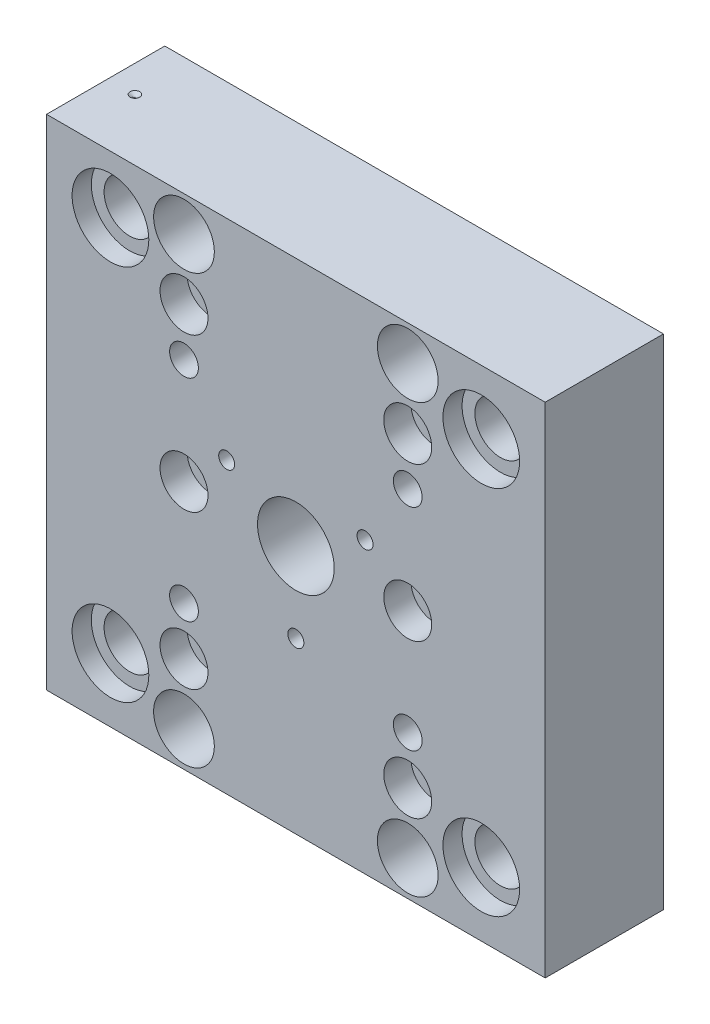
SolidWorks part; units mm, degrees
ref_plane "Plan de face" through (0, 0, 0) normal (0, 0, 1) x (1, 0, 0)
ref_plane "Plan de dessus" through (0, 0, 0) normal (0, 1, 0) x (1, 0, 0)
ref_plane "Plan de droite" through (0, 0, 0) normal (1, 0, 0) x (0, 0, -1)
sketch "Esquisse1" plane through (0, 0, 0) normal (0, 0, 1) x (1, 0, 0)
  line L0 (-78, -78) -> (78, -78)
  line L1 (78, -78) -> (78, 78)
  line L2 (78, 78) -> (-78, 78)
  line L3 (-78, 78) -> (-78, -78)
  circle A0 centre (35, -67) radius 9.5
  circle A1 centre (35, 67) radius 9.5
  circle A2 centre (-35, 67) radius 9.5
  circle A3 centre (-35, -67) radius 9.5
extrude "Extrusion1" add sketch "Esquisse1" along normal blind 37
ref_plane "Plan1" through (0, 0, 37) normal (0, 0, 1) x (1, 0, 0)
sketch "Esquisse2" plane through (0, 0, 37) normal (0, 0, 1) x (1, 0, 0)
  circle A0 centre (-58, 60) radius 8
sketch "Esquisse3" plane through (0, 0, 37) normal (0, 0, 1) x (1, 0, 0)
  circle A0 centre (58, 58) radius 8
sketch "Esquisse4" plane through (0, 0, 37) normal (0, 0, 1) x (1, 0, 0)
  circle A0 centre (58, -58) radius 8
sketch "Esquisse5" plane through (0, 0, 37) normal (0, 0, 1) x (1, 0, 0)
  circle A0 centre (-58, -58) radius 8
sketch "Esquisse6" plane through (0, 0, 37) normal (0, 0, 1) x (1, 0, 0)
  circle A0 centre (-35, 48) radius 7.5
extrude "Enlèv. mat.-Extru.1" cut sketch "Esquisse6" against normal blind 8.5
sketch "Esquisse7" plane through (0, 0, 37) normal (0, 0, 1) x (1, 0, 0)
  circle A0 centre (35, 48) radius 7.5
extrude "Enlèv. mat.-Extru.2" cut sketch "Esquisse7" against normal blind 8.5
sketch "Esquisse8" plane through (0, 0, 37) normal (0, 0, 1) x (1, 0, 0)
  circle A0 centre (-35, 0) radius 7.5
extrude "Enlèv. mat.-Extru.3" cut sketch "Esquisse8" against normal blind 8.5
sketch "Esquisse9" plane through (0, 0, 37) normal (0, 0, 1) x (1, 0, 0)
  circle A0 centre (35, 0) radius 7.5
extrude "Enlèv. mat.-Extru.4" cut sketch "Esquisse9" against normal blind 8.5
sketch "Esquisse10" plane through (0, 0, 37) normal (0, 0, 1) x (1, 0, 0)
  circle A0 centre (-35, -48) radius 7.5
extrude "Enlèv. mat.-Extru.5" cut sketch "Esquisse10" against normal blind 8.5
sketch "Esquisse11" plane through (0, 0, 37) normal (0, 0, 1) x (1, 0, 0)
  circle A0 centre (35, -48) radius 7.5
extrude "Enlèv. mat.-Extru.6" cut sketch "Esquisse11" against normal blind 8.5
sketch "Esquisse12" plane through (0, 0, 37) normal (0, 0, 1) x (1, 0, 0)
  circle A0 centre (35, -48) radius 4.5
extrude "Enlèv. mat.-Extru.7" cut sketch "Esquisse12" against normal blind 37
sketch "Esquisse13" plane through (0, 0, 37) normal (0, 0, 1) x (1, 0, 0)
  circle A0 centre (-35, -48) radius 4.5
extrude "Enlèv. mat.-Extru.8" cut sketch "Esquisse13" against normal blind 37
sketch "Esquisse14" plane through (0, 0, 37) normal (0, 0, 1) x (1, 0, 0)
  circle A0 centre (35, 0) radius 4.5
extrude "Enlèv. mat.-Extru.9" cut sketch "Esquisse14" against normal blind 37
sketch "Esquisse15" plane through (0, 0, 37) normal (0, 0, 1) x (1, 0, 0)
  circle A0 centre (-35, 0) radius 4.5
extrude "Enlèv. mat.-Extru.10" cut sketch "Esquisse15" against normal blind 37
sketch "Esquisse16" plane through (0, 0, 37) normal (0, 0, 1) x (1, 0, 0)
  circle A0 centre (-35, 48) radius 4.5
extrude "Enlèv. mat.-Extru.11" cut sketch "Esquisse16" against normal blind 37
sketch "Esquisse17" plane through (0, 0, 37) normal (0, 0, 1) x (1, 0, 0)
  circle A0 centre (35, 48) radius 4.5
extrude "Enlèv. mat.-Extru.12" cut sketch "Esquisse17" against normal blind 37
sketch "Esquisse18" plane through (0, 0, 37) normal (0, 0, 1) x (1, 0, 0)
  circle A0 centre (-35, 33) radius 4.5
extrude "Enlèv. mat.-Extru.13" cut sketch "Esquisse18" against normal blind 14
sketch "Esquisse19" plane through (0, 0, 37) normal (0, 0, 1) x (1, 0, 0)
  circle A0 centre (35, 33) radius 4.5
extrude "Enlèv. mat.-Extru.14" cut sketch "Esquisse19" against normal blind 14
sketch "Esquisse20" plane through (0, 0, 37) normal (0, 0, 1) x (1, 0, 0)
  circle A0 centre (35, -33) radius 4.5
extrude "Enlèv. mat.-Extru.15" cut sketch "Esquisse20" against normal blind 14
sketch "Esquisse21" plane through (0, 0, 37) normal (0, 0, 1) x (1, 0, 0)
  circle A0 centre (-35, -33) radius 4.5
extrude "Enlèv. mat.-Extru.16" cut sketch "Esquisse21" against normal blind 14
sketch "Esquisse22" plane through (0, 0, 37) normal (0, 0, 1) x (1, 0, 0)
  circle A0 centre (-35, -33) radius 4
extrude "Enlèv. mat.-Extru.17" cut sketch "Esquisse22" against normal blind 37
sketch "Esquisse23" plane through (0, 0, 37) normal (0, 0, 1) x (1, 0, 0)
  circle A0 centre (35, -33) radius 4
extrude "Enlèv. mat.-Extru.18" cut sketch "Esquisse23" against normal blind 37
sketch "Esquisse24" plane through (0, 0, 37) normal (0, 0, 1) x (1, 0, 0)
  circle A0 centre (35, 33) radius 4
extrude "Enlèv. mat.-Extru.19" cut sketch "Esquisse24" against normal blind 37
sketch "Esquisse25" plane through (0, 0, 37) normal (0, 0, 1) x (1, 0, 0)
  circle A0 centre (-35, 33) radius 4
extrude "Enlèv. mat.-Extru.20" cut sketch "Esquisse25" against normal blind 37
ref_plane "Plan2" through (0, 0, 28.5) normal (0, 0, 1) x (1, 0, 0)
sketch "Esquisse26" plane through (0, 0, 37) normal (0, 0, 1) x (1, 0, 0)
  circle A0 centre (-58, 60) radius 12
extrude "Enlèv. mat.-Extru.21" cut sketch "Esquisse26" against normal blind 6
extrude "Enlèv. mat.-Extru.22" cut sketch "Esquisse2" against normal blind 37
sketch "Esquisse27" plane through (0, 0, 37) normal (0, 0, 1) x (1, 0, 0)
  circle A0 centre (-58, -58) radius 12
extrude "Enlèv. mat.-Extru.23" cut sketch "Esquisse27" against normal blind 6
extrude "Enlèv. mat.-Extru.24" cut sketch "Esquisse5" against normal blind 37
sketch "Esquisse28" plane through (0, 0, 37) normal (0, 0, 1) x (1, 0, 0)
  circle A0 centre (58, -58) radius 12
extrude "Enlèv. mat.-Extru.25" cut sketch "Esquisse28" against normal blind 6
extrude "Enlèv. mat.-Extru.26" cut sketch "Esquisse4" against normal blind 37
sketch "Esquisse29" plane through (0, 0, 37) normal (0, 0, 1) x (1, 0, 0)
  circle A0 centre (58, 58) radius 12
extrude "Enlèv. mat.-Extru.27" cut sketch "Esquisse29" against normal blind 6
extrude "Enlèv. mat.-Extru.28" cut sketch "Esquisse3" against normal blind 37
sketch "Esquisse30" plane through (0, 0, 0) normal (0, 0, 1) x (1, 0, 0)
  circle A0 centre (0, 0) radius 12
extrude "Enlèv. mat.-Extru.29" cut sketch "Esquisse30" along normal blind 37
hole_wizard "Trou taraudé M6x1.01" positions "Esquisse32" profile "Esquisse31" tap size "M6x1.0" standard "Ansi Métrique"
sketch "Esquisse32" plane through (0, 0, 37) normal (0, 0, 1) x (1, 0, 0)
  circle A0 centre (0, -25) radius 3.3 construction
  circle A1 centre (21.6506, 12.5) radius 3.3 construction
  circle A2 centre (-21.6506, 12.5) radius 3.3 construction
  point P0 (21.6506, 12.5)
  point P1 (0, -25)
  point P3 (-21.6506, 12.5)
sketch "Esquisse31" plane through (21.6506, 12.5, 37) normal (1, 0, 0) x (0, -1, 0)
  line L0 (0, 0) -> (0, 16.5022)
  line L1 (0, 16.5022) -> (2.5, 15)
  line L2 (2.5, 15) -> (2.5, 0)
  line L5 (2.5, 0) -> (0, 0)
  line L10 (0, 16.5022) -> (-2.5, 15) construction
  line L11 (0, -6.35) -> (0, 107.95) construction
  dimension "Diamètre du trou pour taraudage" = 5
  dimension "Profondeur du trou pour taraudage" = 15
  dimension "Angle de pointe" = 118
hole_wizard "Diamètre du perçage Ø3.0 (3)1" positions "Esquisse35" profile "Esquisse34" hole size "Ø3.0" standard "Ansi Métrique"
sketch "Esquisse35" plane through (0, 78, 0) normal (0, 1, 0) x (-1, 0, 0)
  point P0 (69.5563, 17.7979)
sketch "Esquisse34" plane through (-69.5563, 78, 17.7979) normal (1, 0, 0) x (0, 0, 1)
  line L0 (0, 0) -> (0, 0.9023)
  line L1 (0, 0.9023) -> (1.5, 0.001)
  line L2 (1.5, 0.001) -> (1.5, 0)
  line L5 (1.5, 0) -> (0, 0)
  line L10 (0, 0.9023) -> (-1.5, 0.001) construction
  line L11 (0, -6.35) -> (0, 107.95) construction
  dimension "Diamètre du perçage" = 3
  dimension "Profondeur du perçage" = 0.001
  dimension "Angle de pointe" = 118
